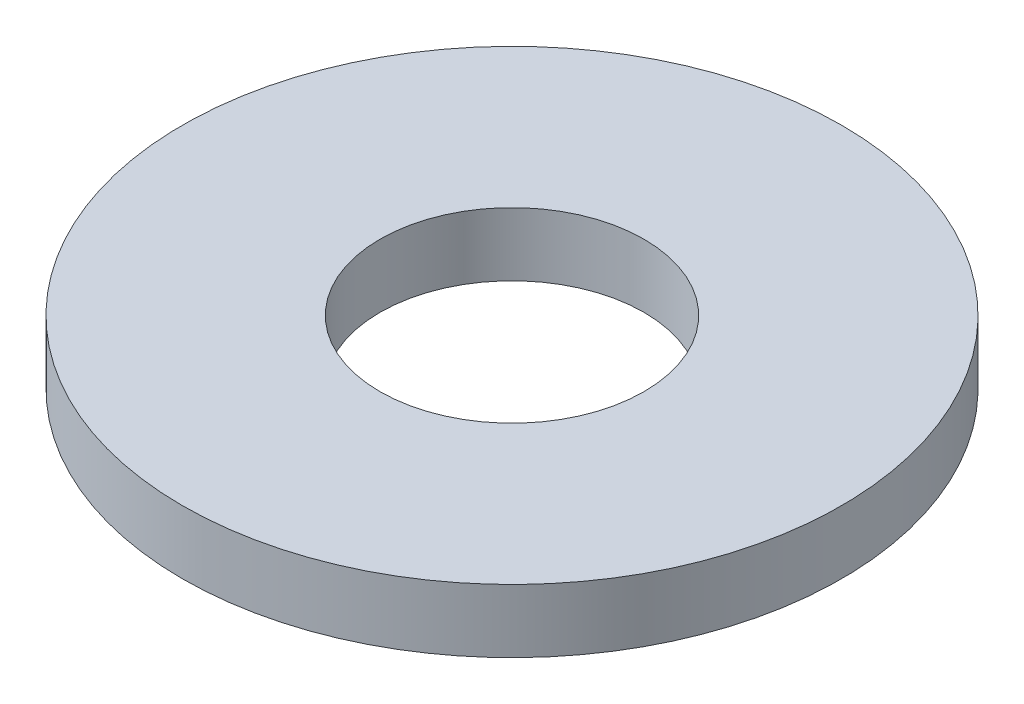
SolidWorks part; units mm, degrees
ref_plane "Front Plane" through (0, 0, 0) normal (0, 0, 1) x (1, 0, 0)
ref_plane "Top Plane" through (0, 0, 0) normal (0, 1, 0) x (1, 0, 0)
ref_plane "Right Plane" through (0, 0, 0) normal (1, 0, 0) x (0, 0, -1)
sketch "Sketch1" plane through (0, 0, 0) normal (0, 1, 0) x (1, 0, 0)
  circle A0 centre (0, 0) radius 3.9624
  dimension "OD" = 7.9248
extrude "Boss-Extrude1" add sketch "Sketch1" along normal blind 0.762
sketch "Sketch5" plane through (0, 0.762, 0) normal (0, 1, 0) x (-1, 0, 0)
  circle A0 centre (0, 0) radius 1.5875
  dimension "ID" = 3.175
extrude "Cut-Extrude1" cut sketch "Sketch5" against normal through all
